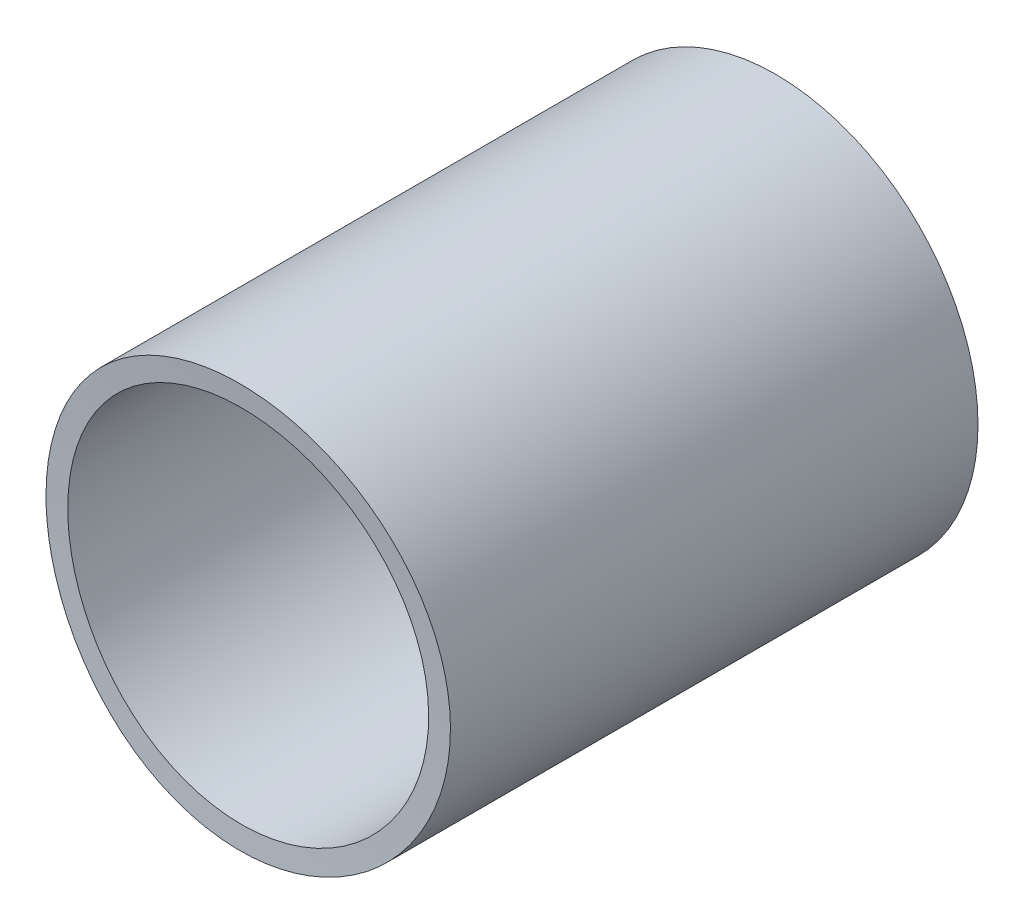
SolidWorks part; units mm, degrees
ref_plane "Plan de face" through (0, 0, 0) normal (0, 0, 1) x (1, 0, 0)
ref_plane "Plan de dessus" through (0, 0, 0) normal (0, 1, 0) x (1, 0, 0)
ref_plane "Plan de droite" through (0, 0, 0) normal (1, 0, 0) x (0, 0, -1)
sketch "Esquisse1" plane through (0, 0, -8) normal (0, 0, 1) x (1, 0, 0)
  circle A0 centre (-500, 0) radius 24.15
  dimension "D1" = 48.3
  dimension "D2" = 500
extrude "Extru.-Mince1" add sketch "Esquisse1" along normal up to surface (653 mm away) thin
sketch "Esquisse2" plane through (0, 0, 0) normal (1, 0, 0) x (0, 0, -1)
  circle A1 centre (-350, 0) radius 295 construction
  circle A2 centre (-350, 0) radius 295
extrude "Enlèv. mat.-Extru.1" cut sketch "Esquisse2" against normal blind 540
